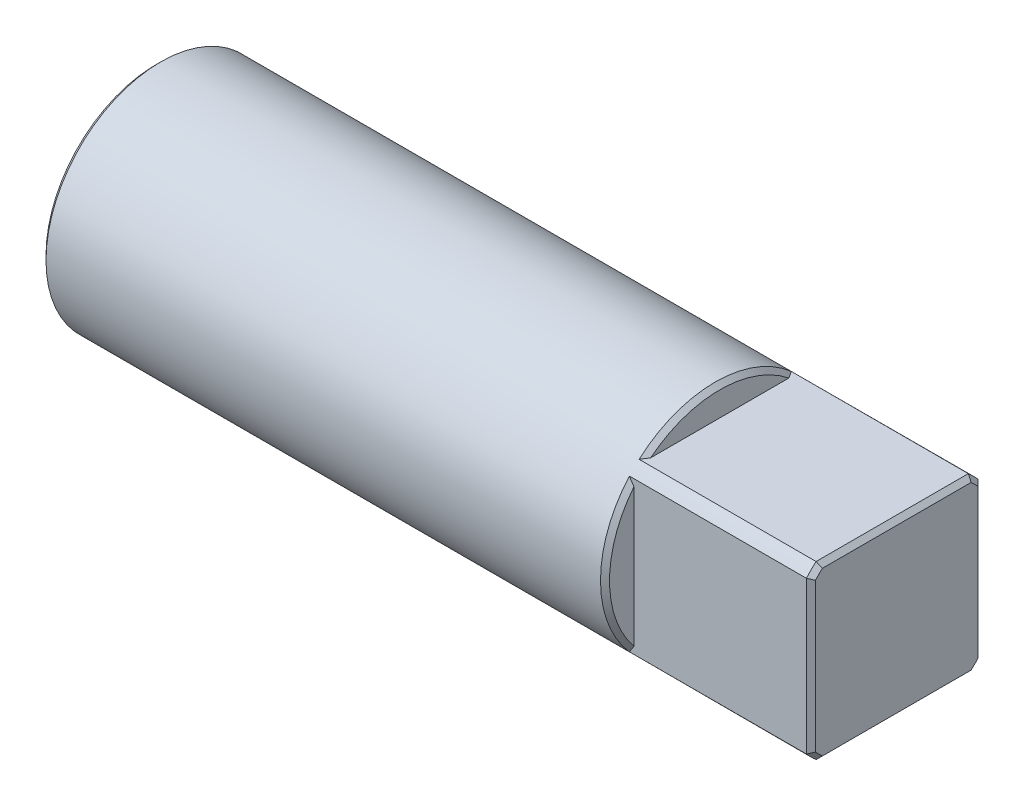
SolidWorks part; units mm, degrees
ref_plane "Спереди" through (0, 0, 0) normal (0, 0, 1) x (1, 0, 0)
ref_plane "Сверху" through (0, 0, 0) normal (0, 1, 0) x (1, 0, 0)
ref_plane "Справа" through (0, 0, 0) normal (1, 0, 0) x (0, 0, -1)
sketch "Эскиз1" plane through (0, 0, 0) normal (1, 0, 0) x (0, 0, -1)
  circle A0 centre (0, 0) radius 6.35
  dimension "D1" = 12.7
extrude "Бобышка-Вытянуть1" add sketch "Эскиз1" along normal blind 41
sketch "Эскиз2" plane through (41, 0, 0) normal (1, 0, 0) x (0, 0, -1)
  line L1 (4.75, 4.75) -> (-4.75, 4.75)
  line L2 (4.75, 4.75) -> (4.75, -4.75)
  line L3 (4.75, -4.75) -> (-4.75, -4.75)
  line L4 (-4.75, 4.75) -> (-4.75, -4.75)
  line L5 (4.75, 4.75) -> (-4.75, -4.75) construction
  line L6 (4.75, -4.75) -> (-4.75, 4.75) construction
  point P0 (0, 0)
  dimension "D1" = 9.5
extrude "Вырез-Вытянуть1" cut sketch "Эскиз2" against normal blind 9.8 flip side to cut
chamfer "Фаска1" distance 0.25 angle 45 13 edges at (41, 4.75, 0) (41, 4.4901, -4.4901) (41, 0, -4.75) (41, -4.4901, -4.4901) (41, -4.75, 0) (41, -4.4901, 4.4901) (41, 0, 4.75) (41, 4.4901, 4.4901) (31.2, -6.35, 0) (31.2, 0, -6.35) (31.2, 0, 6.35) (31.2, 6.35, 0) (0, 0, -6.35)
